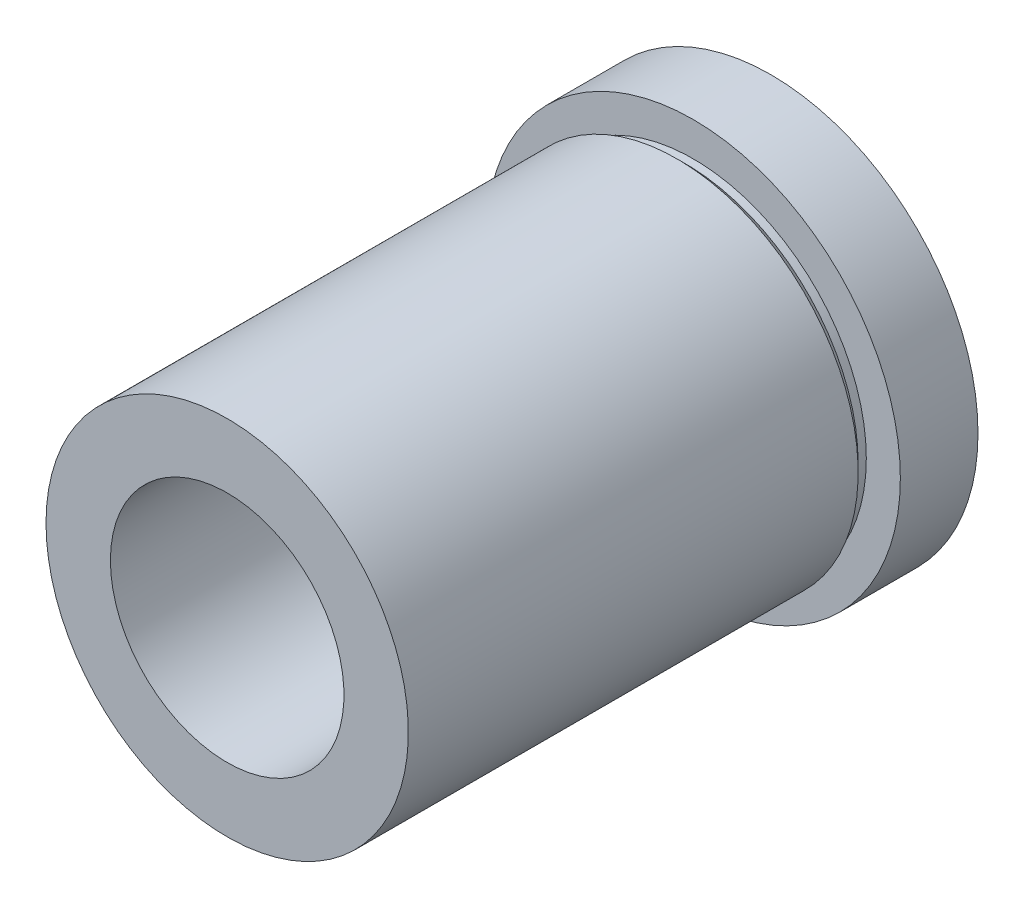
SolidWorks part; units mm, degrees
ref_plane "Front" through (0, 0, 0) normal (0, 0, 1) x (1, 0, 0)
ref_plane "Top" through (0, 0, 0) normal (0, 1, 0) x (1, 0, 0)
ref_plane "Right" through (0, 0, 0) normal (1, 0, 0) x (0, 0, -1)
sketch "Logo3_Revol_Axis" plane through (0, 0, 0) normal (0, 1, 0) x (1, 0, 0)
  line L0 (0, -30.1653) -> (0, 30.1653) construction
sketch "Logo3_bib1" plane through (0, 0, 0) normal (0, -1, 0) x (-1, 0, 0)
  line L1 (7.1628, -28.5874) -> (11.1125, -28.5874)
  line L2 (11.1125, -28.5874) -> (11.1125, -1)
  line L4 (10.6125, 0) -> (10.6125, -0.5)
  line L5 (10.6125, 0) -> (12.7, 0)
  line L6 (12.7, 0) -> (12.7, 4.7625)
  line L8 (7.1628, 4.7625) -> (7.1628, -28.5874)
  line L9 (12.7, 4.7625) -> (7.1628, 4.7625)
  line L10 (0, 41.5372) -> (0, -40.1764) construction
  line L11 (11.1125, -1) -> (10.6125, -0.5)
  dimension "D1" = 4.7625
  dimension "D2" = 45
  dimension "logo3_l1" = 33.3499
  dimension "logo3_d3" = 22.225
  dimension "logo3_d4" = 25.4
  dimension "rainure" = 1
  dimension "logo3_l3" = 28.5874
  dimension "prof_rainure" = 0.5
  dimension "logo3_d1_blank" = 14.3256
revolve "Revolve1" add sketch "Logo3_bib1" angle 360 about L10
